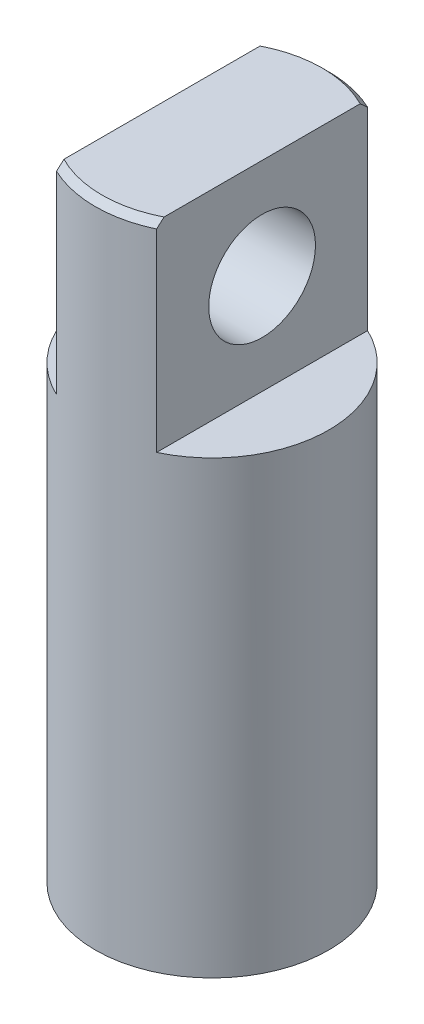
SolidWorks part; units mm, degrees
ref_plane "Front Plane" through (0, 0, 0) normal (0, 0, 1) x (1, 0, 0)
ref_plane "Top Plane" through (0, 0, 0) normal (0, 1, 0) x (1, 0, 0)
ref_plane "Right Plane" through (0, 0, 0) normal (1, 0, 0) x (0, 0, -1)
sketch "Sketch1" plane through (0, 0, 0) normal (0, 1, 0) x (1, 0, 0)
  circle A0 centre (0, 0) radius 3.5
  dimension "D1" = 7
extrude "Boss-Extrude1" add sketch "Sketch1" against normal blind 13.5
sketch "Sketch2" plane through (0, 0, 0) normal (0, 1, 0) x (1, 0, 0)
  line L0 (0, -3.5) -> (0, 3.5) construction
  line L1 (1.5, -3.1623) -> (1.5, 3.1623)
  line L2 (-1.5, -3.1623) -> (-1.5, 3.1623)
  line L3 (-1.5, -3.5) -> (-1.5, 3.5) construction
  line L4 (1.5, -3.5) -> (1.5, 3.5) construction
  arc A0 (-1.5, -3.1623) -> (1.5, -3.1623) centre (0, 0) ccw
  arc A1 (1.5, 3.1623) -> (-1.5, 3.1623) centre (0, 0) ccw
  dimension "D1" = 7
  dimension "D2" = 1.5
  dimension "D3" = 1.5
extrude "Boss-Extrude2" add sketch "Sketch2" along normal blind 6
sketch "Sketch3" plane through (1.5, 0, 0) normal (1, 0, 0) x (0, 0, -1)
  line L2 (-3.1623, 6) -> (3.1623, 6) construction
  circle A0 centre (0, 3) radius 1.6
  dimension "D1" = 3.2
  dimension "D2" = 3
extrude "Cut-Extrude1" cut sketch "Sketch3" against normal up to surface (3 mm away)
chamfer "Chamfer1" distance 0.2 angle 45 2 edges at (0, 6, 3.5) (0, 6, -3.5)
